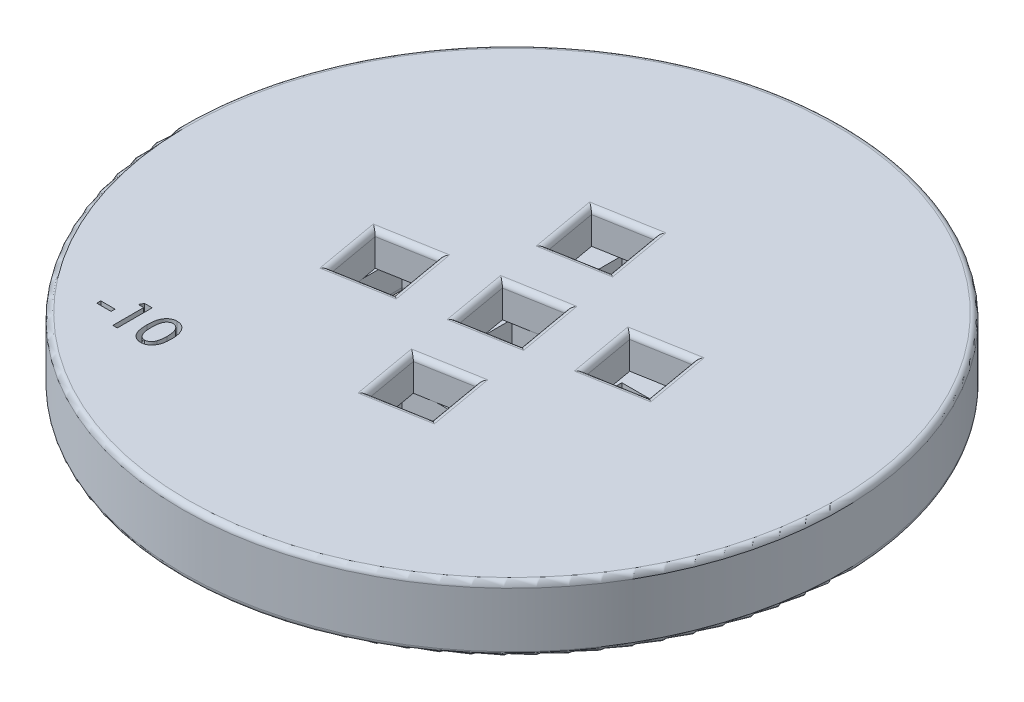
SolidWorks part; units mm, degrees
ref_plane "Front Plane" through (0, 0, 0) normal (0, 0, 1) x (1, 0, 0)
ref_plane "Top Plane" through (0, 0, 0) normal (0, 1, 0) x (1, 0, 0)
ref_plane "Right Plane" through (0, 0, 0) normal (1, 0, 0) x (0, 0, -1)
sketch "Sketch1" plane through (0, 0, 0) normal (0, 1, 0) x (1, 0, 0)
  circle A0 centre (0, 0) radius 30
extrude "Boss-Extrude1" add sketch "Sketch1" along normal blind 6
sketch "Sketch2" plane through (0, 6, 0) normal (0, 1, 0) x (1, 0, 0)
  line L0 (0, 0) -> (0, -10) construction
  line L1 (0, 0) -> (10, 0) construction
  line L2 (0, 0) -> (-10, 0) construction
  line L3 (0, 0) -> (0, 10) construction
  line L5 (-2.5, -7.5) -> (2.5, -7.5)
  line L6 (-2.5, -7.5) -> (-2.5, -12.5)
  line L7 (-2.5, -12.5) -> (2.5, -12.5)
  line L8 (2.5, -7.5) -> (2.5, -12.5)
  line L9 (-2.5, -7.5) -> (2.5, -12.5) construction
  line L10 (-2.5, -12.5) -> (2.5, -7.5) construction
  line L11 (-7.5, -2.5) -> (-12.5, -2.5)
  line L12 (-7.5, -2.5) -> (-7.5, 2.5)
  line L13 (-7.5, 2.5) -> (-12.5, 2.5)
  line L14 (-12.5, -2.5) -> (-12.5, 2.5)
  line L15 (-7.5, -2.5) -> (-12.5, 2.5) construction
  line L16 (-7.5, 2.5) -> (-12.5, -2.5) construction
  line L17 (2.5, -2.5) -> (-2.5, -2.5)
  line L18 (2.5, -2.5) -> (2.5, 2.5)
  line L19 (2.5, 2.5) -> (-2.5, 2.5)
  line L20 (-2.5, -2.5) -> (-2.5, 2.5)
  line L21 (2.5, -2.5) -> (-2.5, 2.5) construction
  line L22 (2.5, 2.5) -> (-2.5, -2.5) construction
  line L23 (-2.5, 12.5) -> (2.5, 12.5)
  line L24 (-2.5, 12.5) -> (-2.5, 7.5)
  line L25 (-2.5, 7.5) -> (2.5, 7.5)
  line L26 (2.5, 12.5) -> (2.5, 7.5)
  line L27 (-2.5, 12.5) -> (2.5, 7.5) construction
  line L28 (-2.5, 7.5) -> (2.5, 12.5) construction
  line L29 (12.5, -2.5) -> (7.5, -2.5)
  line L30 (12.5, -2.5) -> (12.5, 2.5)
  line L31 (12.5, 2.5) -> (7.5, 2.5)
  line L32 (7.5, -2.5) -> (7.5, 2.5)
  line L33 (12.5, -2.5) -> (7.5, 2.5) construction
  line L34 (12.5, 2.5) -> (7.5, -2.5) construction
  dimension "D1" = 5
  dimension "D2" = 10
  dimension "D3" = 5
  dimension "D4" = 5
  dimension "D5" = 5
  dimension "D6" = 5
  dimension "D7" = 5
  dimension "D8" = 5
sketch "Sketch3" plane through (0, 6, 0) normal (0, 1, 0) x (1, 0, 0)
sketch "Sketch4" plane through (0, 0, 0) normal (0, -1, 0) x (-1, 0, 0)
  line L0 (0, 0) -> (-10, 0) construction
  line L1 (0, 0) -> (0, -10) construction
  line L2 (0, 0) -> (0, 10) construction
  line L3 (0, 0) -> (10, 0) construction
  line L5 (-2.5, 2.5) -> (2.5, 2.5)
  line L6 (-2.5, 2.5) -> (-2.5, -2.5)
  line L7 (-2.5, -2.5) -> (2.5, -2.5)
  line L8 (2.5, 2.5) -> (2.5, -2.5)
  line L9 (-2.5, 2.5) -> (2.5, -2.5) construction
  line L10 (-2.5, -2.5) -> (2.5, 2.5) construction
  line L11 (-2.5, -7.5) -> (2.5, -7.5)
  line L12 (-2.5, -7.5) -> (-2.5, -12.5)
  line L13 (-2.5, -12.5) -> (2.5, -12.5)
  line L14 (2.5, -7.5) -> (2.5, -12.5)
  line L15 (-2.5, -7.5) -> (2.5, -12.5) construction
  line L16 (-2.5, -12.5) -> (2.5, -7.5) construction
  line L17 (7.5, 2.5) -> (12.5, 2.5)
  line L18 (7.5, 2.5) -> (7.5, -2.5)
  line L19 (7.5, -2.5) -> (12.5, -2.5)
  line L20 (12.5, 2.5) -> (12.5, -2.5)
  line L21 (7.5, 2.5) -> (12.5, -2.5) construction
  line L22 (7.5, -2.5) -> (12.5, 2.5) construction
  line L23 (-12.5, 2.5) -> (-7.5, 2.5)
  line L24 (-12.5, 2.5) -> (-12.5, -2.5)
  line L25 (-12.5, -2.5) -> (-7.5, -2.5)
  line L26 (-7.5, 2.5) -> (-7.5, -2.5)
  line L27 (-12.5, 2.5) -> (-7.5, -2.5) construction
  line L28 (-12.5, -2.5) -> (-7.5, 2.5) construction
  line L29 (2.5, 7.5) -> (-2.5, 7.5)
  line L30 (2.5, 7.5) -> (2.5, 12.5)
  line L31 (2.5, 12.5) -> (-2.5, 12.5)
  line L32 (-2.5, 7.5) -> (-2.5, 12.5)
  line L33 (2.5, 7.5) -> (-2.5, 12.5) construction
  line L34 (2.5, 12.5) -> (-2.5, 7.5) construction
  dimension "D1" = 5
  dimension "D2" = 5
  dimension "D3" = 5
  dimension "D4" = 5
  dimension "D5" = 5
  dimension "D6" = 5
extrude "Cut-Extrude2" cut sketch "Sketch4" against normal blind 3
fillet "Fillet2" radius 0.5 21 edges at (0, 0, 30) (2.5, 0, 0) (0, 0, 2.5) (-2.5, 0, 0) (0, 0, -2.5) (2.5, 0, 10) (0, 0, 12.5) (-2.5, 0, 10) (0, 0, 7.5) (-7.5, 0, 0) (-10, 0, 2.5) (-12.5, 0, 0) (-10, 0, -2.5) (12.5, 0, 0) (10, 0, 2.5) (7.5, 0, 0) (10, 0, -2.5) (-2.5, 0, -10) (0, 0, -12.5) (2.5, 0, -10) (0, 0, -7.5)
fillet "Fillet3" radius 0.5 1 edges at (0, 6, 30)
sketch "Sketch5" plane through (0, 6, 0) normal (0, 1, 0) x (1, 0, 0)
sketch "Sketch6" plane through (0, 6, 0) normal (0, 1, 0) x (1, 0, 0)
  line L0 (0, -30) -> (0, 30) construction
  line L1 (0, 0) -> (-5.2094, 29.5442) construction
  line L2 (-2.0279, -2.8961) -> (2.8961, -2.0279)
  line L3 (-2.0279, -2.8961) -> (-2.8961, 2.0279)
  line L4 (2.8961, -2.0279) -> (2.0279, 2.8961)
  line L5 (-2.8961, 2.0279) -> (2.0279, 2.8961)
  line L6 (-2.0279, -2.8961) -> (2.0279, 2.8961) construction
  line L7 (2.8961, -2.0279) -> (-2.8961, 2.0279) construction
  line L8 (-3.7644, 6.9519) -> (1.1597, 7.8202)
  line L9 (-3.7644, 6.9519) -> (-4.6326, 11.876)
  line L10 (1.1597, 7.8202) -> (0.2914, 12.7442)
  line L11 (-4.6326, 11.876) -> (0.2914, 12.7442)
  line L12 (-3.7644, 6.9519) -> (0.2914, 12.7442) construction
  line L13 (1.1597, 7.8202) -> (-4.6326, 11.876) construction
  line L14 (0, 0) -> (5.1226, -29.0518) construction
  line L15 (4.6326, -11.876) -> (-0.2914, -12.7442)
  line L16 (4.6326, -11.876) -> (3.7644, -6.9519)
  line L17 (-0.2914, -12.7442) -> (-1.1597, -7.8202)
  line L18 (3.7644, -6.9519) -> (-1.1597, -7.8202)
  line L19 (4.6326, -11.876) -> (-1.1597, -7.8202) construction
  line L20 (-0.2914, -12.7442) -> (3.7644, -6.9519) construction
  line L21 (0, 0) -> (-29.0518, -5.1226) construction
  line L22 (0, 0) -> (29.0518, 5.1226) construction
  line L23 (12.7442, -0.2914) -> (7.8202, -1.1597)
  line L24 (12.7442, -0.2914) -> (11.876, 4.6326)
  line L25 (7.8202, -1.1597) -> (6.9519, 3.7644)
  line L26 (11.876, 4.6326) -> (6.9519, 3.7644)
  line L27 (12.7442, -0.2914) -> (6.9519, 3.7644) construction
  line L28 (7.8202, -1.1597) -> (11.876, 4.6326) construction
  line L29 (-11.876, -4.6326) -> (-6.9519, -3.7644)
  line L30 (-11.876, -4.6326) -> (-12.7442, 0.2914)
  line L31 (-6.9519, -3.7644) -> (-7.8202, 1.1597)
  line L32 (-12.7442, 0.2914) -> (-7.8202, 1.1597)
  line L33 (-11.876, -4.6326) -> (-7.8202, 1.1597) construction
  line L34 (-6.9519, -3.7644) -> (-12.7442, 0.2914) construction
  line L35 (-19.7925, -19.1465) -> (-12.6703, -19.1465) construction
  circle A0 centre (0, 0) radius 30 construction
  circle A1 centre (0, 0) radius 29.5 construction
  text T0 "<b>-10</b>"
  point P8 (-1.7365, 9.8481)
  point P21 (1.7365, -9.8481)
  point P23 (9.8481, 1.7365)
  point P28 (-9.8481, -1.7365)
  dimension "D1" = 10
  dimension "D2" = 5
  dimension "D3" = 5
  dimension "D4" = 10
  dimension "D5" = 5
  dimension "D6" = 5
  dimension "D7" = 10
  dimension "D8" = 5
  dimension "D9" = 5
  dimension "D10" = 90
  dimension "D11" = 90
  dimension "D12" = 10
  dimension "D13" = 5
  dimension "D14" = 5
  dimension "D15" = 180
  dimension "D16" = 5
  dimension "D17" = 5
  dimension "D18" = 180
  dimension "D19" = 10
  dimension "D20" = 10
extrude "Cut-Extrude3" cut sketch "Sketch6" against normal blind 3
fillet "Fillet5" radius 0.5 20 edges at (10.2822, 6, 0.7255) (12.3101, 6, -2.1706) (7.3861, 6, -1.3024) (9.414, 6, -4.1985) (-1.3024, 6, -7.3861) (0.7255, 6, -10.2822) (-2.1706, 6, -12.3101) (-4.1985, 6, -9.414) (0.4341, 6, 2.462) (-2.462, 6, 0.4341) (-0.4341, 6, -2.462) (2.462, 6, -0.4341) (2.1706, 6, 12.3101) (4.1985, 6, 9.414) (1.3024, 6, 7.3861) (-0.7255, 6, 10.2822) (-9.414, 6, 4.1985) (-7.3861, 6, 1.3024) (-10.2822, 6, -0.7255) (-12.3101, 6, 2.1706)
